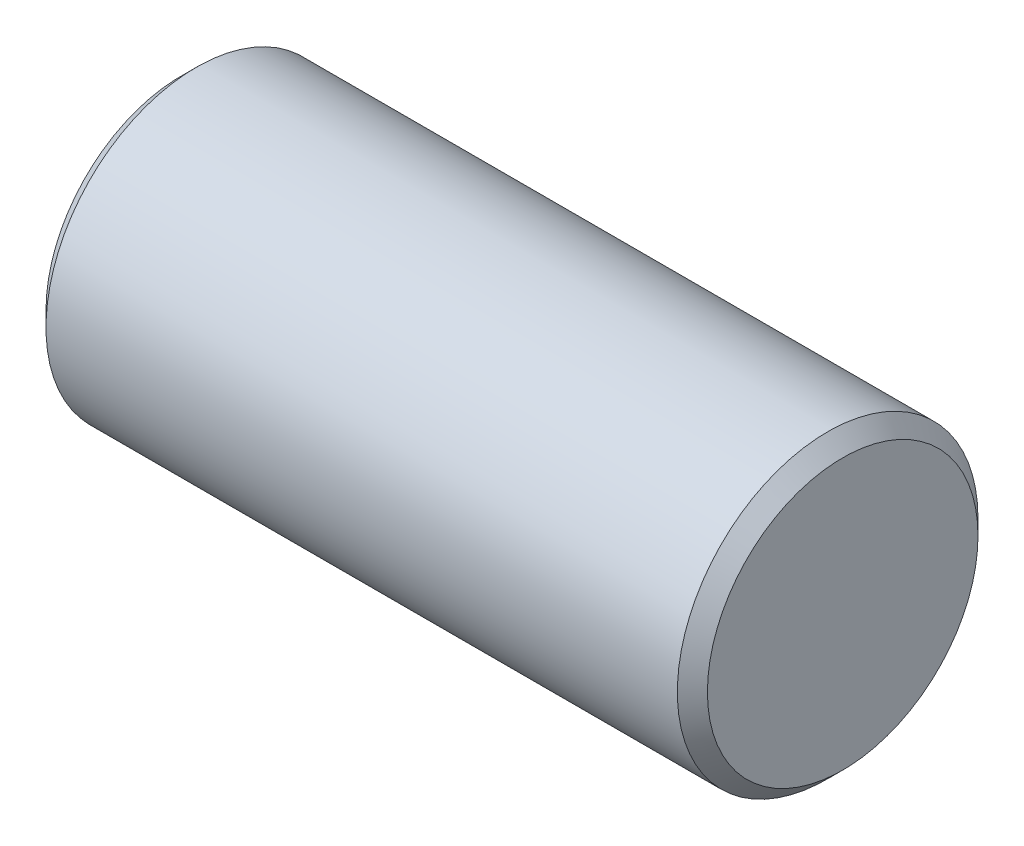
SolidWorks part; units mm, degrees
ref_plane "Plan de face" through (0, 0, 0) normal (0, 0, 1) x (1, 0, 0)
ref_plane "Plan de dessus" through (0, 0, 0) normal (0, 1, 0) x (1, 0, 0)
ref_plane "Plan de droite" through (0, 0, 0) normal (1, 0, 0) x (0, 0, -1)
sketch "Esquisse1" plane through (0, 0, 0) normal (1, 0, 0) x (0, 0, -1)
  circle A0 centre (0, 0) radius 5
  dimension "D1" = 10
extrude "Extrusion1" add sketch "Esquisse1" along normal mid plane 22
chamfer "Chanfrein1" distance 0.5 angle 45 2 edges at (-11, 0, -5) (11, 0, -5)
